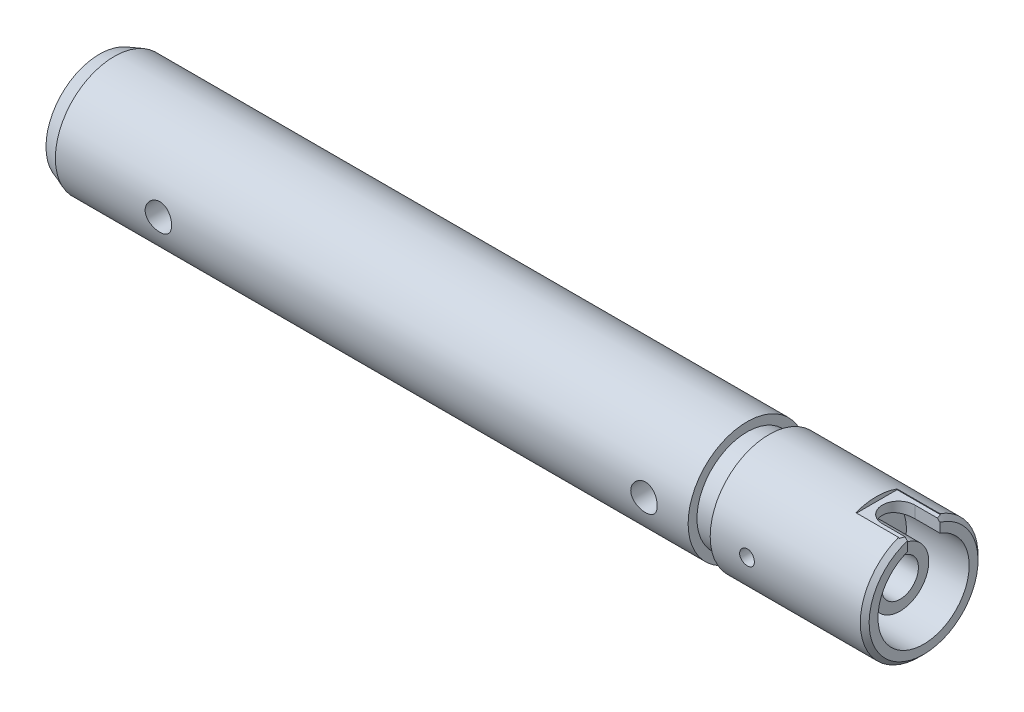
SolidWorks part; units mm, degrees
ref_plane "Vorne" through (0, 0, 0) normal (0, 0, 1) x (1, 0, 0)
ref_plane "Oben" through (0, 0, 0) normal (0, 1, 0) x (1, 0, 0)
ref_plane "Rechts" through (0, 0, 0) normal (1, 0, 0) x (0, 0, -1)
ref_plane "Ebene1" through (0, 0, 8) normal (0, 0, 1) x (1, 0, 0)
sketch "Skizze1" plane through (0, 0, 8) normal (0, 0, 1) x (1, 0, 0)
  line L0 (24.4145, 2.5) -> (24.4145, 3.636) construction
  line L1 (24.4145, 2.5) -> (24.4145, 3.636)
  line L2 (24.4145, 3.636) -> (25.4145, 4) construction
  line L3 (25.4145, 4) -> (68.4145, 4) construction
  line L4 (68.4145, 4) -> (68.4145, 3.4) construction
  line L5 (68.4145, 3.4) -> (69.9145, 3.4) construction
  line L6 (69.9145, 3.4) -> (69.9145, 4) construction
  line L7 (69.9145, 4) -> (80.4145, 4) construction
  line L8 (80.4145, 4) -> (80.4145, 3.1) construction
  line L9 (80.4145, 3.1) -> (76.1445, 3.1) construction
  line L10 (76.1445, 3.1) -> (76.1445, 1.95) construction
  line L11 (76.1445, 1.95) -> (78.8145, 1.95) construction
  line L12 (78.8145, 1.95) -> (78.8145, 1.25) construction
  line L13 (78.8145, 1.25) -> (62.9092, 1.25) construction
  line L14 (62.9092, 1.25) -> (62.9092, 2) construction
  line L15 (62.9092, 2) -> (36.9092, 2) construction
  line L16 (36.9092, 2) -> (36.9092, 2.5) construction
  line L17 (36.9092, 2.5) -> (24.4145, 2.5) construction
  line L18 (24.4145, 3.636) -> (25.4145, 4)
  line L19 (25.4145, 4) -> (68.4145, 4)
  line L20 (68.4145, 4) -> (68.4145, 3.4)
  line L21 (68.4145, 3.4) -> (69.9145, 3.4)
  line L22 (69.9145, 3.4) -> (69.9145, 4)
  line L23 (69.9145, 4) -> (80.4145, 4)
  line L24 (80.4145, 4) -> (80.4145, 3.1)
  line L25 (80.4145, 3.1) -> (76.1445, 3.1)
  line L26 (76.1445, 3.1) -> (76.1445, 1.95)
  line L27 (76.1445, 1.95) -> (78.8145, 1.95)
  line L28 (78.8145, 1.95) -> (78.8145, 1.25)
  line L29 (78.8145, 1.25) -> (62.9092, 1.25)
  line L30 (62.9092, 1.25) -> (62.9092, 2)
  line L31 (62.9092, 2) -> (36.9092, 2)
  line L32 (36.9092, 2) -> (36.9092, 2.5)
  line L33 (36.9092, 2.5) -> (24.4145, 2.5)
  line L34 (24.4145, 2.5) -> (24.4145, 3.636)
  line L35 (0, 0) -> (113.9649, 0) construction
  line L36 (0, 0) -> (113.9649, 0) construction
revolve "Rotation1" add sketch "Skizze1" angle 360 about L36
sketch "Skizze2" plane through (0, 0, 0) normal (0, 0, 1) x (1, 0, 0)
  line L0 (62.9092, 0) -> (36.9092, 0) construction
  line L1 (78.8145, 0) -> (62.9092, 0) construction
  line L2 (24.4145, 3.636) -> (24.4145, -3.636) construction
  line L3 (80.4145, -4) -> (80.4145, 4) construction
  circle A0 centre (32.4145, 0) radius 0.9
  circle A1 centre (72.4145, 0) radius 0.5
  circle A2 centre (65.4145, 0) radius 0.9
  dimension "D1" = 1.8
  dimension "D2" = 1
  dimension "D5" = 15
  dimension "D3" = 8
  dimension "D4" = 8
extrude "Schnitt-Linear austragen2" cut sketch "Skizze2" along normal through all
sketch "Skizze6" plane through (0, 0, 8) normal (0, 0, 1) x (1, 0, 0)
  line L1 (77.2145, 4) -> (80.4145, 4)
  line L2 (77.2145, 4) -> (77.2145, 3.7)
  line L3 (77.2145, 3.7) -> (80.4145, 3.7)
  line L4 (80.4145, 4) -> (80.4145, 3.7)
  line L5 (80.4145, -4) -> (80.4145, 4) construction
  line L6 (80.4145, 0) -> (69.9145, 0) construction
  line L7 (80.4145, 4) -> (69.9145, 4) construction
  dimension "D1" = 3.7
  dimension "D2" = 3.2
extrude "Schnitt-Linear austragen7" cut sketch "Skizze6" against normal mid plane 2.8
sketch "Skizze5" plane through (0, 3.7, 0) normal (0, 1, 0) x (1, 0, 0)
  line L0 (80.4145, -6.9) -> (78.7145, -6.9)
  line L2 (78.7145, -9.1) -> (80.4145, -9.1)
  line L3 (80.4145, -9.1) -> (80.4145, -6.9)
  line L4 (78.7145, -8) -> (80.4145, -8) construction
  line L5 (78.8145, -8) -> (62.9092, -8) construction
  line L6 (80.4145, -6.6) -> (80.4145, -9.4) construction
  arc A0 (78.7145, -6.9) -> (78.7145, -9.1) centre (78.7145, -8) ccw
  dimension "D1" = 2.2
  dimension "D2" = 2.8
extrude "Schnitt-Linear austragen6" cut sketch "Skizze5" against normal up to next
chamfer "Fase1" distance 0.3 angle 45 1 edges at (80.4145, -4, 8)
